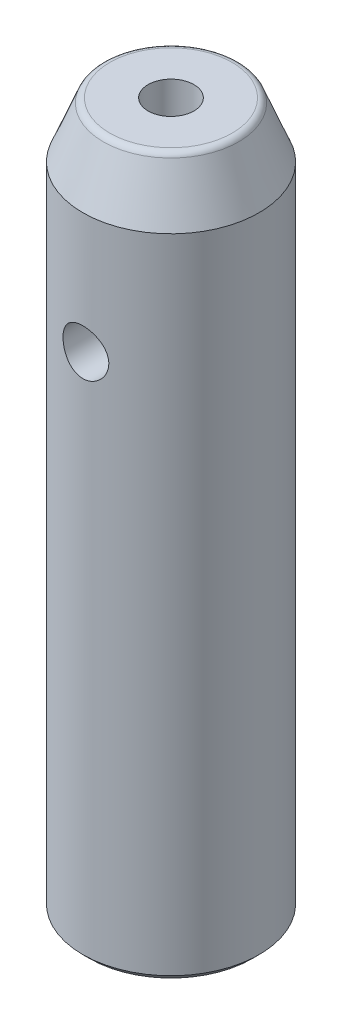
SolidWorks part; units mm, degrees
ref_plane "前基準面" through (0, 0, 0) normal (0, 0, 1) x (1, 0, 0)
ref_plane "上基準面" through (0, 0, 0) normal (0, 1, 0) x (1, 0, 0)
ref_plane "右基準面" through (0, 0, 0) normal (1, 0, 0) x (0, 0, -1)
sketch "草圖1" plane through (0, 0, 0) normal (0, 1, 0) x (1, 0, 0)
  circle A0 centre (0, 0) radius 6.35
  dimension "D1" = 12.7
extrude "填料-伸長1" add sketch "草圖1" along normal blind 50.8
hole_wizard "M4x0.7 螺紋孔1" positions "草圖3" profile "草圖2" tap size "M4x0.7" standard "Ansi Metric"
sketch "草圖3" plane through (0, 50.8, 0) normal (0, 1, 0) x (1, 0, 0)
  point P0 (0, 0)
sketch "草圖2" plane through (0, 50.8, 0) normal (1, 0, 0) x (0, 0, 1)
  line L0 (0, 0) -> (0, 11.0914)
  line L1 (0, 11.0914) -> (1.65, 10.1)
  line L2 (1.65, 10.1) -> (1.65, 0)
  line L5 (1.65, 0) -> (0, 0)
  line L10 (0, 11.0914) -> (-1.65, 10.1) construction
  line L11 (0, -6.35) -> (0, 107.95) construction
  dimension "螺孔鑽直徑" = 3.3
  dimension "螺孔鑽深度" = 10.1
  dimension "導頭角度" = 118
hole_wizard "M6x1.0 螺紋孔1" positions "草圖5" profile "草圖4" tap size "M6x1.0" standard "Ansi Metric"
sketch "草圖5" plane through (0, 0, 0) normal (0, -1, 0) x (-1, 0, 0)
  point P0 (0, 0)
sketch "草圖4" plane through (0, 0, 0) normal (1, 0, 0) x (0, 0, -1)
  line L0 (0, 0) -> (0, 12.5022)
  line L1 (0, 12.5022) -> (2.5, 11)
  line L2 (2.5, 11) -> (2.5, 0)
  line L5 (2.5, 0) -> (0, 0)
  line L10 (0, 12.5022) -> (-2.5, 11) construction
  line L11 (0, -6.35) -> (0, 107.95) construction
  dimension "螺孔鑽直徑" = 5
  dimension "螺孔鑽深度" = 11
  dimension "導頭角度" = 118
chamfer "導角1" distance 4 distance2 1.6 1 edges at (0, 50.8, 6.35)
fillet "圓角1" radius 0.5 1 edges at (0, 50.8, 4.75)
chamfer "導角2" distance 0.5 angle 45 1 edges at (0, 0, 6.35)
ref_plane "平面1" through (0, 0, 6.35) normal (0, 0, 1) x (1, 0, 0)
sketch "草圖6" plane through (0, 0, 6.35) normal (0, 0, 1) x (1, 0, 0)
  line L0 (1.65, 50.8) -> (-1.65, 50.8) construction
  circle A0 centre (0, 38.1) radius 1.65
  dimension "D2" = 3.3
  dimension "D1" = 12.7
extrude "除料-伸長1" cut sketch "草圖6" against normal through all
